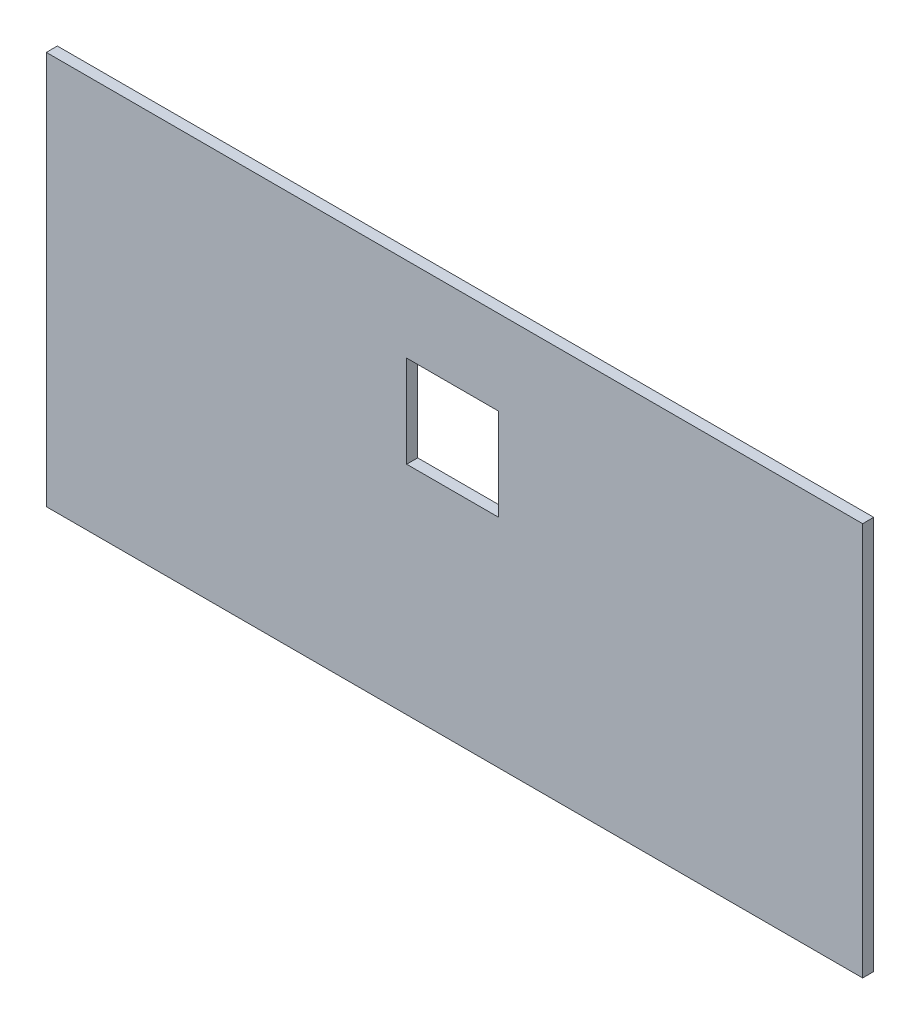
SolidWorks part; units mm, degrees
ref_plane "Plan de face" through (0, 0, 0) normal (0, 0, 1) x (1, 0, 0)
ref_plane "Plan de dessus" through (0, 0, 0) normal (0, 1, 0) x (1, 0, 0)
ref_plane "Plan de droite" through (0, 0, 0) normal (1, 0, 0) x (0, 0, -1)
sketch "Esquisse1" plane through (0, 0, 0) normal (0, 0, 1) x (1, 0, 0)
  line L1 (0, 0) -> (222, 0)
  line L2 (0, 0) -> (0, 107)
  line L3 (0, 107) -> (222, 107)
  line L4 (222, 0) -> (222, 107)
  dimension "D1" = 222
  dimension "D2" = 107
extrude "Extrusion1" add sketch "Esquisse1" along normal blind 3
sketch "Esquisse2" plane through (0, 0, 3) normal (0, 0, 1) x (1, 0, 0)
  line L0 (0, 107) -> (0, 0) construction
  line L1 (98, 59) -> (123, 59)
  line L2 (98, 59) -> (98, 84)
  line L3 (98, 84) -> (123, 84)
  line L4 (123, 59) -> (123, 84)
  line L5 (0, 0) -> (222, 0) construction
  dimension "D1" = 25
  dimension "D2" = 25
  dimension "D3" = 98
  dimension "D4" = 59
extrude "Enlèv. mat.-Extru.1" cut sketch "Esquisse2" against normal blind 3
